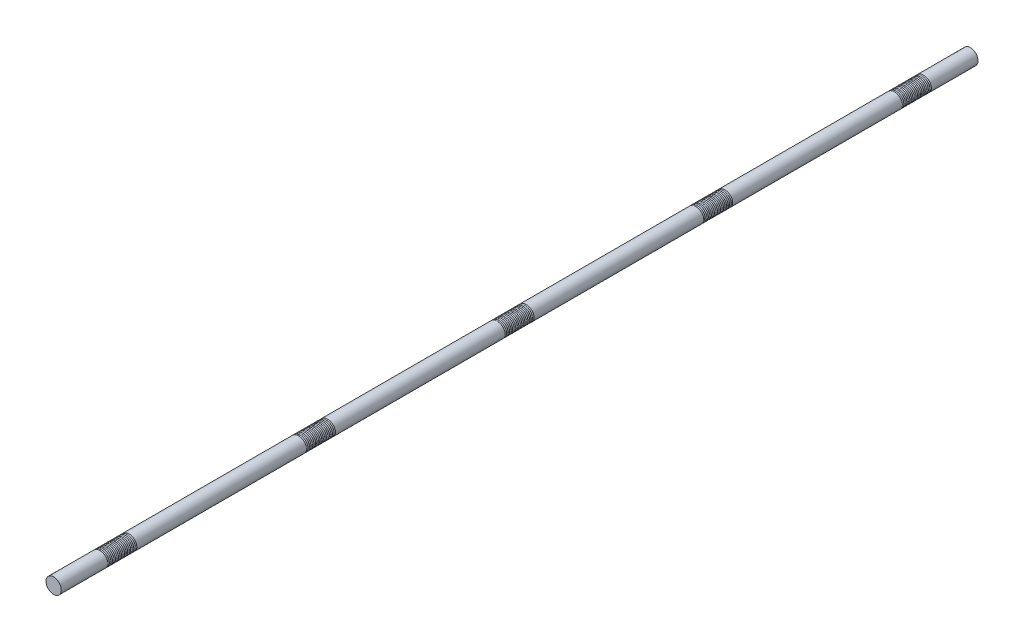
SolidWorks part; units mm, degrees
ref_plane "Front Plane" through (0, 0, 0) normal (0, 0, 1) x (1, 0, 0)
ref_plane "Top Plane" through (0, 0, 0) normal (0, 1, 0) x (1, 0, 0)
ref_plane "Right Plane" through (0, 0, 0) normal (1, 0, 0) x (0, 0, -1)
sketch "Sketch1" plane through (0, 0, 0) normal (0, 0, 1) x (1, 0, 0)
  circle A0 centre (0, 0) radius 25
  dimension "D1" = 50
extrude "Boss-Extrude1" add sketch "Sketch1" along normal blind 3000
ref_plane "Plane1" through (0, 0, 150) normal (0, 0, 1) x (1, 0, 0)
sketch "Sketch2" plane through (0, 0, 150) normal (0, 0, 1) x (1, 0, 0)
  circle A0 centre (0, 0) radius 27.1167
  dimension "D1" = 54.2333
curve "Helix/Spiral1"
sketch "Sketch3" plane through (0, 0, 0) normal (0, 1, 0) x (1, 0, 0)
  circle A0 centre (-27.1167, -150) radius 3.175
  spline S0 degree 3 number of poles 233 (-27.1167, -150) -> (-27.1167, -250) construction
  dimension "D1" = 6.35
sweep "Cut-Sweep1" cut profiles "Sketch3" path "Helix/Spiral1"
pattern_linear "LPattern1" count 5 spacing 650 along (0, 0, -1) of "Cut-Sweep1"
